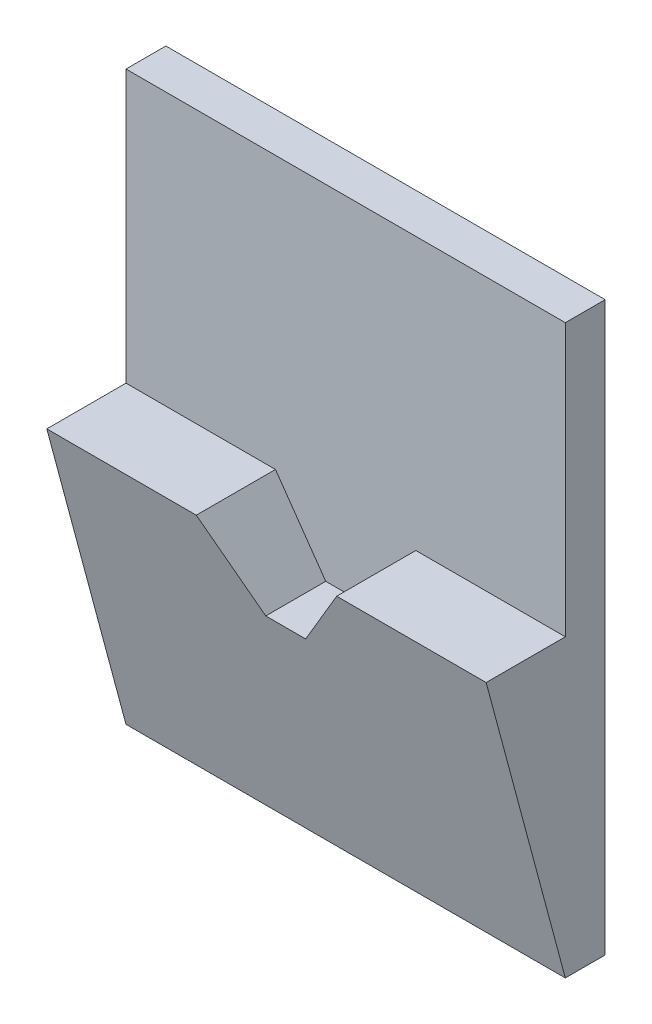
SolidWorks part; units mm, degrees
ref_plane "Front Plane" through (0, 0, 0) normal (0, 0, 1) x (1, 0, 0)
ref_plane "Top Plane" through (0, 0, 0) normal (0, 1, 0) x (1, 0, 0)
ref_plane "Right Plane" through (0, 0, 0) normal (1, 0, 0) x (0, 0, -1)
sketch "Sketch1" plane through (0, 0, 0) normal (0, 0, 1) x (1, 0, 0)
  line L1 (-57.1809, 69.3343) -> (54.7901, 69.3343)
  line L2 (-57.1809, 69.3343) -> (-57.1809, -75.3114)
  line L3 (-57.1809, -75.3114) -> (54.7901, -75.3114)
  line L4 (54.7901, 69.3343) -> (54.7901, -75.3114)
extrude "Extrude1" add sketch "Sketch1" along normal mid plane 10.16
ref_plane "Plane2" through (0, 0, 30.48) normal (0, 0, 1) x (1, 0, 0)
sketch "Sketch5" plane through (0, 0, 30.48) normal (0, 0, 1) x (1, 0, 0)
  line L0 (-57.1809, 0) -> (-19.0809, 0)
  line L1 (-57.1809, 69.3343) -> (-57.1809, -75.3114) construction
  line L2 (-19.0809, 0) -> (-6.2754, -18.2881)
  line L3 (-6.2754, -18.2881) -> (3.8846, -18.2881)
  line L4 (3.8846, -18.2881) -> (16.6901, 0)
  line L5 (16.6901, 0) -> (54.7901, 0)
  line L6 (54.7901, -75.3114) -> (54.7901, 69.3343) construction
ref_plane "Plane3" through (80.1901, 0, 0) normal (1, 0, 0) x (0, 0, -1)
draft "Draft1" draft angle 15 parameters "D1"=15
